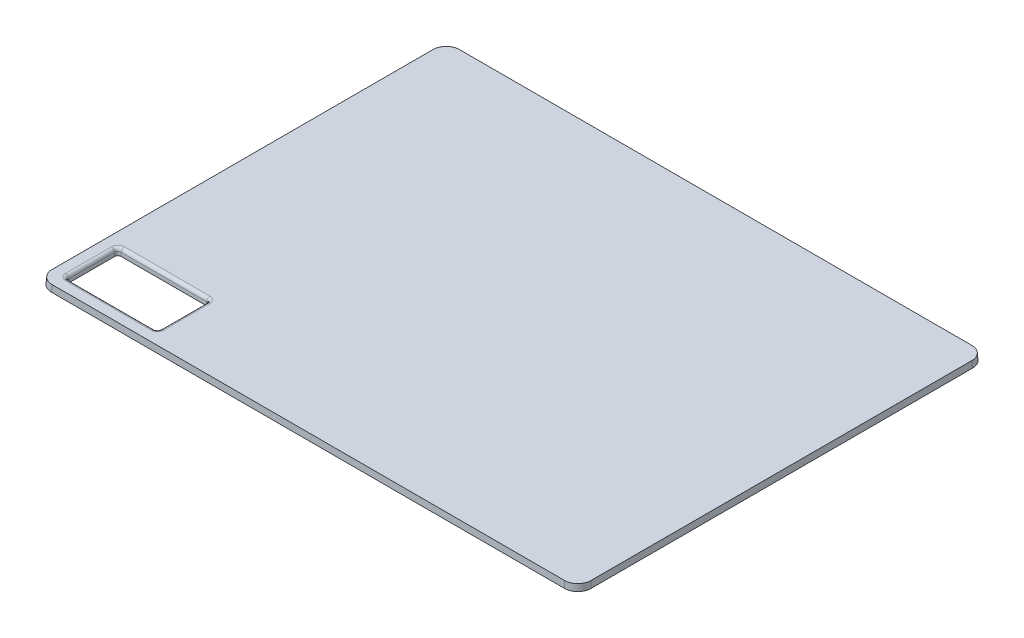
SolidWorks part; units mm, degrees
ref_plane "Front" through (0, 0, 0) normal (0, 0, 1) x (1, 0, 0)
ref_plane "Top" through (0, 0, 0) normal (0, 1, 0) x (1, 0, 0)
ref_plane "Right" through (0, 0, 0) normal (1, 0, 0) x (0, 0, -1)
sketch "Sketch1" plane through (0, 0, 0) normal (0, 1, 0) x (1, 0, 0)
  line L1 (0, 0) -> (260.35, 0)
  line L2 (0, 0) -> (0, 196.85)
  line L3 (0, 196.85) -> (260.35, 196.85)
  line L4 (260.35, 0) -> (260.35, 196.85)
  dimension "D1" = 260.35
  dimension "D2" = 196.85
extrude "Extrude1" add sketch "Sketch1" along normal blind 3.175 draft 3
fillet "Fillet3" radius 6.35 4 edges at (0.0832, 1.5875, -196.7668) (260.2668, 1.5875, -196.7668) (260.2668, 1.5875, -0.0832) (0.0832, 1.5875, -0.0832)
sketch "Sketch2" plane through (0, 3.175, 0) normal (0, 1, 0) x (-1, 0, 0)
  line L0 (-0.1664, -190.3423) -> (-0.1664, -6.5077) construction
  line L1 (-6.5164, -6.5164) -> (-50.9664, -6.5164)
  line L2 (-6.5164, -6.5164) -> (-6.5164, -31.9164)
  line L3 (-6.5164, -31.9164) -> (-50.9664, -31.9164)
  line L4 (-50.9664, -6.5164) -> (-50.9664, -31.9164)
  line L5 (-6.5077, -0.1664) -> (-253.8423, -0.1664) construction
  dimension "D1" = 6.35
  dimension "D2" = 6.35
  dimension "D3" = 44.45
  dimension "D4" = 25.4
extrude "Cut-Extrude1" cut sketch "Sketch2" against normal through all draft 3
fillet "Fillet1" radius 1.5875 4 edges at (50.8832, 1.5875, -31.8332) (50.8832, 1.5875, -6.5996) (6.5996, 1.5875, -6.5996) (6.5996, 1.5875, -31.8332)
fillet "Fillet2" radius 1.5875 8 edges at (6.9805, 3.175, -6.9805) (6.5164, 3.175, -19.2164) (6.9805, 3.175, -31.4523) (28.7414, 3.175, -31.9164) (50.5023, 3.175, -31.4523) (50.9664, 3.175, -19.2164) (50.5023, 3.175, -6.9805) (28.7414, 3.175, -6.5164)
